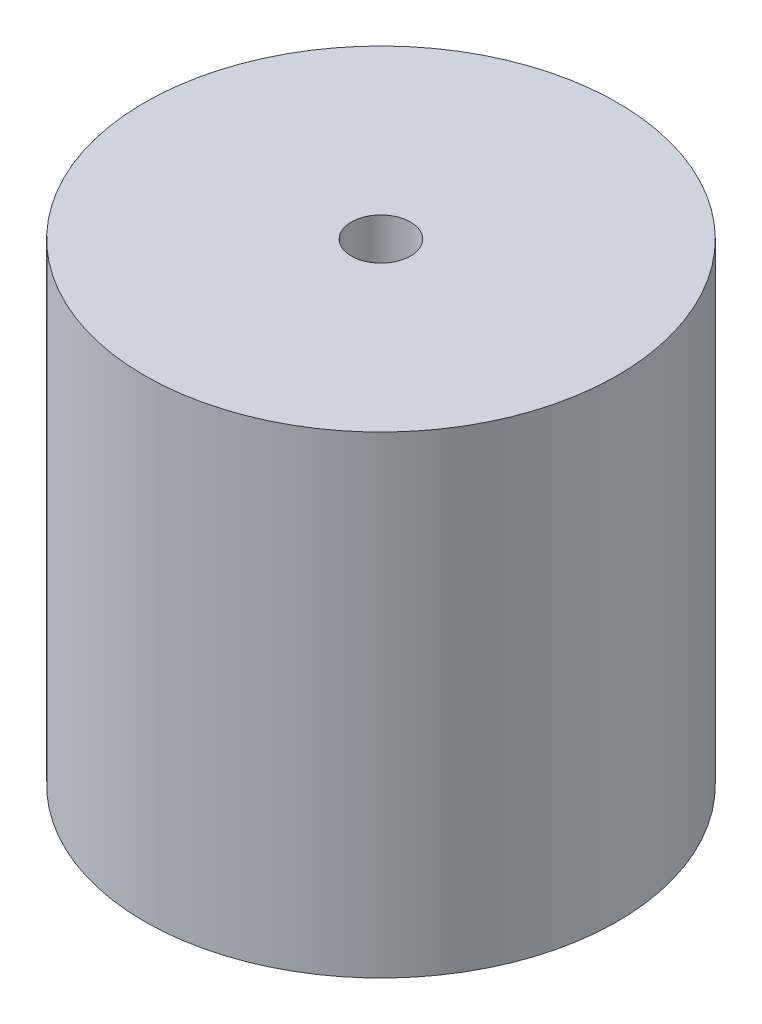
SolidWorks part; units mm, degrees
ref_plane "Front Plane" through (0, 0, 0) normal (0, 0, 1) x (1, 0, 0)
ref_plane "Top Plane" through (0, 0, 0) normal (0, 1, 0) x (1, 0, 0)
ref_plane "Right Plane" through (0, 0, 0) normal (1, 0, 0) x (0, 0, -1)
sketch "Sketch1" plane through (0, 0, 0) normal (0, 1, 0) x (1, 0, 0)
  circle A0 centre (0, 0) radius 12.7
  dimension "D1" = 25.4
extrude "Extrude1" add sketch "Sketch1" along normal blind 25.4
hole_wizard "1/8 (0.125) Diameter Hole1" positions "3DSketch1" profile "Sketch3" hole size "1/8" standard "Ansi Inch"
sketch3d "3DSketch1"
  line L0 (0, 25.4, 0) -> (0, 0, 0) construction
  point P0 (0, 25.4, 0)
sketch "Sketch3" plane through (0, 25.4, 0) normal (1, 0, 0) x (0, 0, 1)
  line L0 (0, 0) -> (0, 25.4)
  line L1 (0, 25.4) -> (1.5875, 25.4)
  line L2 (1.5875, 25.4) -> (1.5875, 0)
  line L5 (1.5875, 0) -> (0, 0)
  line L11 (0, -6.35) -> (0, 107.95) construction
  dimension "Thru Hole Dia." = 3.175
  dimension "Thru Hole Depth" = 25.4
